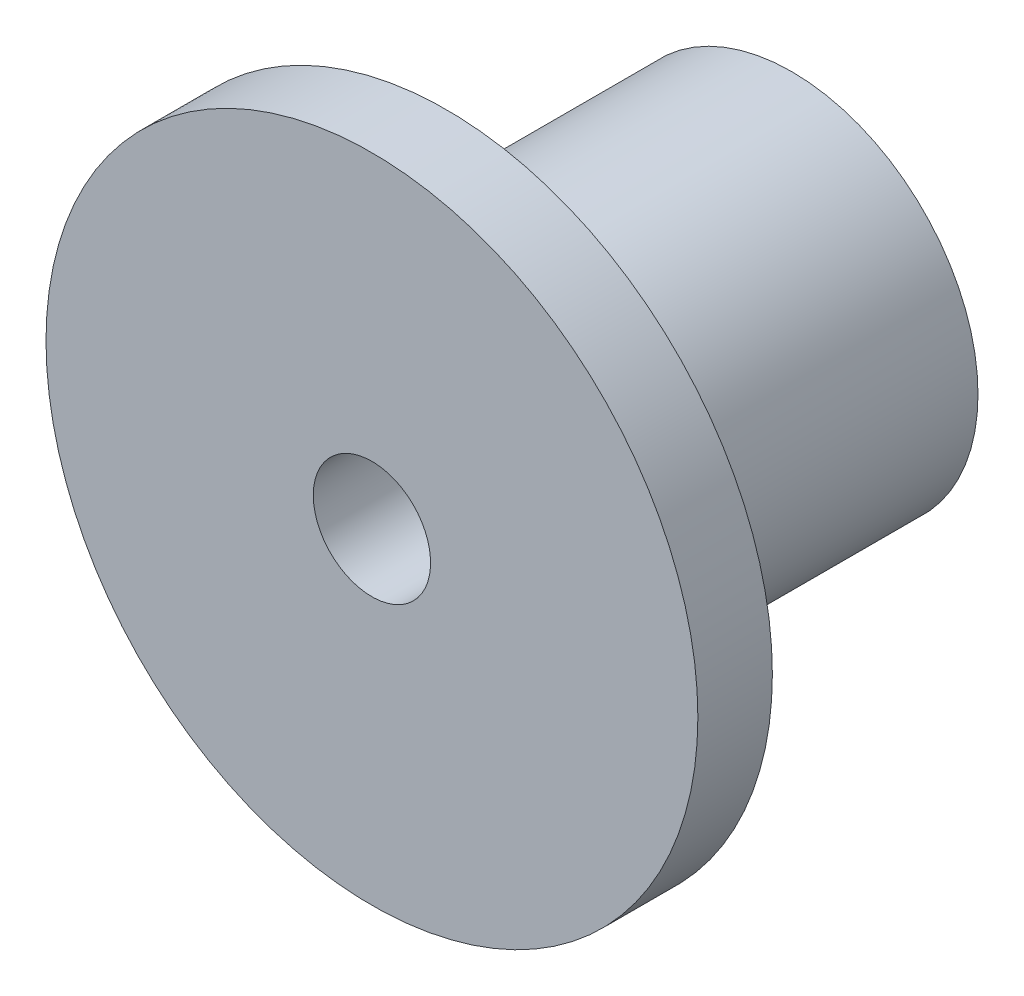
SolidWorks part; units mm, degrees
ref_plane "Front Plane" through (0, 0, 0) normal (0, 0, 1) x (1, 0, 0)
ref_plane "Top Plane" through (0, 0, 0) normal (0, 1, 0) x (1, 0, 0)
ref_plane "Right Plane" through (0, 0, 0) normal (1, 0, 0) x (0, 0, -1)
sketch "Sketch1" plane through (0, 0, 0) normal (0, 0, 1) x (1, 0, 0)
  circle A0 centre (0, 0) radius 11.1125
extrude "flange" add sketch "Sketch1" along normal blind 2.54
sketch "Sketch2" plane through (0, 0, 2.54) normal (0, 0, 1) x (1, 0, 0)
  circle A0 centre (0, 0) radius 6.35
extrude "hub" add sketch "Sketch2" against normal blind 14.3129
sketch "Sketch3" plane through (0, 0, -11.7729) normal (0, 0, -1) x (-1, 0, 0)
  circle A0 centre (0, 0) radius 2
extrude "hole" cut sketch "Sketch3" against normal through all
